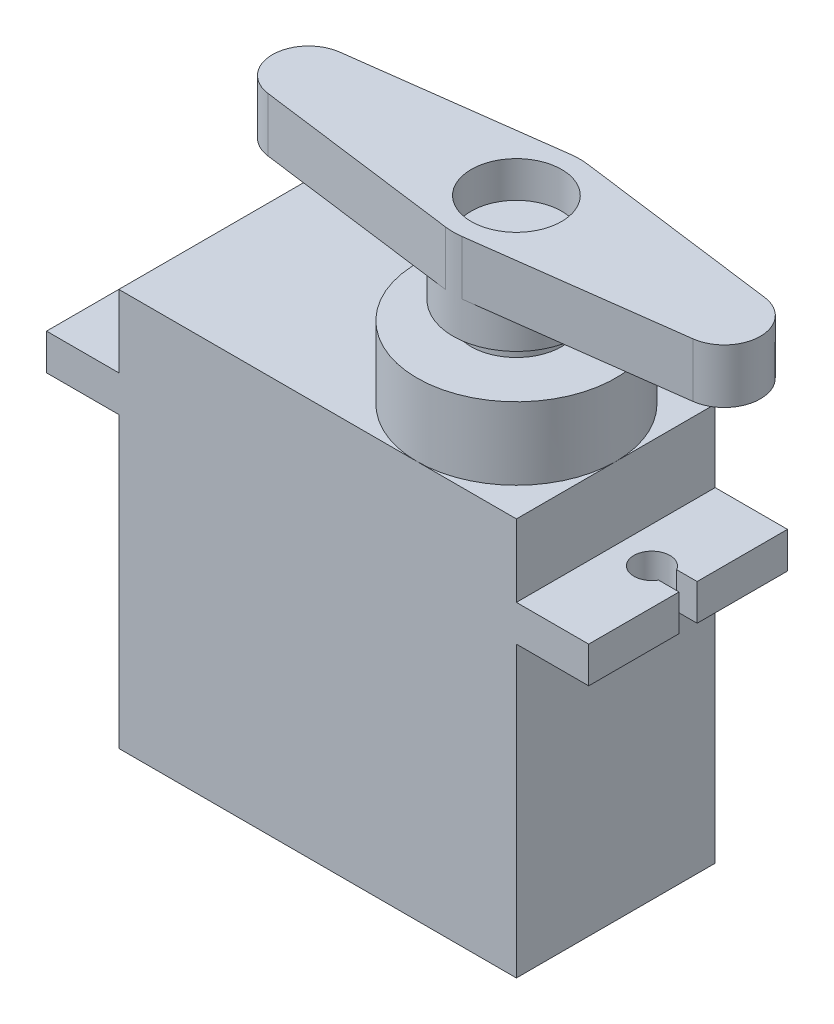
SolidWorks part; units mm, degrees
ref_plane "Front Plane" through (0, 0, 0) normal (0, 0, 1) x (1, 0, 0)
ref_plane "Top Plane" through (0, 0, 0) normal (0, 1, 0) x (1, 0, 0)
ref_plane "Right Plane" through (0, 0, 0) normal (1, 0, 0) x (0, 0, -1)
sketch "Sketch1" plane through (0, 0, 0) normal (0, 1, 0) x (1, 0, 0)
  line L1 (-11, 5.5) -> (11, 5.5)
  line L2 (-11, 5.5) -> (-11, -5.5)
  line L3 (-11, -5.5) -> (11, -5.5)
  line L4 (11, 5.5) -> (11, -5.5)
  line L5 (-11, 5.5) -> (11, -5.5) construction
  line L6 (-11, -5.5) -> (11, 5.5) construction
  point P0 (0, 0)
  dimension "D1" = 22
  dimension "D2" = 11
extrude "Boss-Extrude1" add sketch "Sketch1" along normal blind 22
sketch "Sketch2" plane through (11, 0, 0) normal (1, 0, 0) x (0, 0, -1)
  line L0 (-5.5, 22) -> (-5.5, 0) construction
  line L1 (-5.5, 18) -> (5.5, 18)
  line L2 (-5.5, 18) -> (-5.5, 16)
  line L3 (-5.5, 16) -> (5.5, 16)
  line L4 (5.5, 18) -> (5.5, 16)
  line L5 (5.5, 22) -> (5.5, 0) construction
  line L6 (-5.5, 22) -> (5.5, 22) construction
  dimension "D1" = 4
  dimension "D2" = 2
extrude "Boss-Extrude2" add sketch "Sketch2" along normal blind 4
sketch "Sketch3" plane through (0, 18, 0) normal (0, 1, 0) x (1, 0, 0)
  line L0 (15, 0) -> (11, 0) construction
  line L1 (15, 5.5) -> (15, -5.5) construction
  line L2 (11, -5.5) -> (11, 5.5) construction
  line L3 (15, 0.5) -> (13.866, 0.5)
  line L4 (15, -0.5) -> (13.866, -0.5)
  line L5 (15, 0.5) -> (15, -0.5)
  arc A0 (13.866, 0.5) -> (13.866, -0.5) centre (13, 0) ccw
  point P9 (13, 0)
  dimension "D2" = 2
  dimension "D1" = 2
  dimension "D3" = 1
extrude "Cut-Extrude2" cut sketch "Sketch3" against normal up to surface (2 mm away)
mirror "Mirror1" about plane through (0, 0, 0) normal (1, 0, 0) of "Cut-Extrude2", "Boss-Extrude2"
sketch "Sketch4" plane through (0, 22, 0) normal (0, 1, 0) x (1, 0, 0)
  line L0 (11, 5.5) -> (-11, 5.5) construction
  line L1 (11, -5.5) -> (11, 5.5) construction
  line L2 (-11, -5.5) -> (11, -5.5) construction
  circle A0 centre (5.5, 0) radius 5.5
extrude "Boss-Extrude3" add sketch "Sketch4" along normal blind 4 contours A0
sketch "Sketch5" plane through (0, 26, 0) normal (0, 1, 0) x (1, 0, 0)
  circle A0 centre (5.5, 0) radius 2.5
  point P0 (5.5, 0)
  dimension "D1" = 5
extrude "Boss-Extrude4" add sketch "Sketch5" along normal blind 4
sketch "Sketch6" plane through (0, 0, 0) normal (0, -1, 0) x (1, 0, 0)
  line L0 (11, 0) -> (-11, 0) construction
  line L1 (11, 5.5) -> (11, -5.5) construction
  line L2 (-11, -5.5) -> (-11, 5.5) construction
  point P6 (0, 0)
sketch "Sketch7" plane through (0, 30, 0) normal (0, 1, 0) x (1, 0, 0)
  circle A0 centre (5.5, 0) radius 2.5 construction
  circle A1 centre (5.5, 0) radius 2.5
  circle A2 centre (5.5, 0) radius 3.5
  dimension "D1" = 7
extrude "Boss-Extrude5" add sketch "Sketch7" against normal blind 3 and the other way blind 2
sketch "Sketch8" plane through (0, 32, 0) normal (0, 1, 0) x (1, 0, 0)
  line L0 (11, 0) -> (17, 0) construction
  line L1 (5.9565, 3.4701) -> (17.2609, 1.9829)
  line L2 (5.9565, -3.4701) -> (17.2609, -1.9829)
  line L3 (5.5, 3.5) -> (5.5, -3.5) construction
  line L4 (5.0435, -3.4701) -> (-6.2609, -1.9829)
  line L5 (5.0435, 3.4701) -> (-6.2609, 1.9829)
  arc A0 (17.2609, -1.9829) -> (17.2609, 1.9829) centre (17, 0) ccw
  circle A1 centre (5.5, 0) radius 3.5 construction
  arc A2 (5.9565, -3.4701) -> (5.9565, 3.4701) centre (5.5, 0) ccw
  arc A3 (5.0435, -3.4701) -> (5.0435, 3.4701) centre (5.5, 0) cw
  arc A4 (-6.2609, -1.9829) -> (-6.2609, 1.9829) centre (-6, 0) cw
  dimension "D2" = 4
  dimension "D1" = 6
extrude "Boss-Extrude6" add sketch "Sketch8" against normal blind 3
ref_plane "Plane1" through (0, 0, 0) normal (1, 0, 0) x (0, 0, -1)
